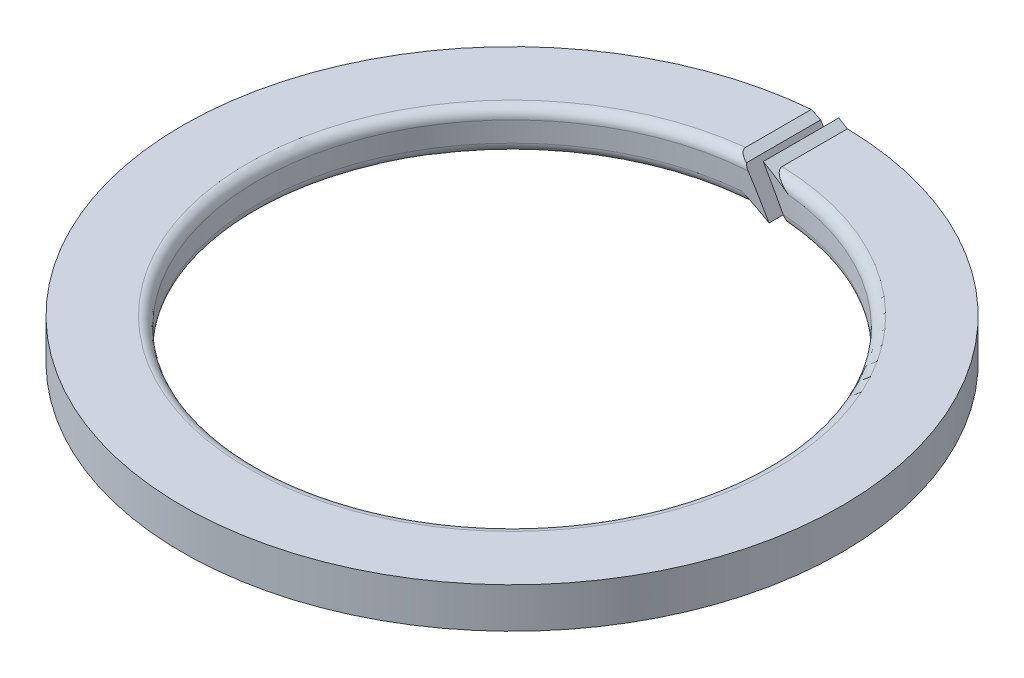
SolidWorks part; units mm, degrees
ref_plane "Front Plane" through (0, 0, 0) normal (0, 0, 1) x (1, 0, 0)
ref_plane "Top Plane" through (0, 0, 0) normal (0, 1, 0) x (1, 0, 0)
ref_plane "Right Plane" through (0, 0, 0) normal (1, 0, 0) x (0, 0, -1)
sketch "BodySke" plane through (0, 0, 0) normal (0, 0, 1) x (1, 0, 0)
  line L0 (0, 0) -> (0, 99.9596) construction
  line L1 (0, 0) -> (50.5, 0) construction
  line L3 (50.5, -10) -> (65.5, -10)
  line L4 (50.5, -10) -> (50.5, 10)
  line L5 (50.5, 10) -> (65.5, 10)
  line L6 (65.5, -10) -> (65.5, 10)
  line L7 (50.5, -4) -> (65.5, -4) construction
  line L8 (50.5, -4) -> (50.5, 4) construction
  line L9 (50.5, 4) -> (65.5, 4) construction
  line L10 (65.5, -4) -> (65.5, 4) construction
  dimension "Inner_dia" = 101
  dimension "Outer_dia" = 131
  dimension "D3" = 20
  dimension "Thickness" = 8
revolve "BaseBody" add sketch "BodySke" angle 360 about L0
sketch "Cut-ExtraSke" plane through (0, 0, 0) normal (0, 0, 1) x (1, 0, 0)
  line L1 (65.5, -4) -> (-65.5, -4)
  line L2 (65.5, -4) -> (65.5, -10)
  line L3 (65.5, -10) -> (-65.5, -10)
  line L4 (-65.5, -4) -> (-65.5, -10)
  line L5 (65.5, 4) -> (-65.5, 4)
  line L6 (65.5, 4) -> (65.5, 10)
  line L7 (65.5, 10) -> (-65.5, 10)
  line L8 (-65.5, 4) -> (-65.5, 10)
extrude "Cut-Extra" cut sketch "Cut-ExtraSke" along normal through all
sketch "ASke" plane through (0, 0, 0) normal (0, 0, 1) x (1, 0, 0)
  line L0 (0, -16.7192) -> (0, 28.802) construction
  line L1 (65.5, 4) -> (-65.5, 4) construction
  line L2 (0.5774, -5) -> (-4.6188, 4) construction
  line L4 (0.5774, -5) -> (-1.1547, -4)
  line L7 (-5.7735, 4) -> (-4.0415, 3)
  line L8 (-0.5774, 5) -> (4.6188, -4) construction
  line L9 (4.0415, -3) -> (5.7735, -4)
  line L10 (-65.5, 10) -> (65.5, 10)
  line L11 (-0.5774, 5) -> (1.1547, 4)
  line L12 (65.5, -4) -> (-65.5, -4) construction
  line L13 (65.5, 10) -> (65.5, 4)
  line L14 (65.5, 4) -> (1.1547, 4)
  line L15 (5.7735, -4) -> (65.5, -4)
  line L16 (65.5, -4) -> (65.5, -10)
  line L17 (65.5, -10) -> (-65.5, -10)
  line L18 (-65.5, -10) -> (-65.5, -4)
  line L19 (-65.5, -4) -> (-1.1547, -4)
  line L20 (0.5774, -5) -> (-4.0415, 3)
  line L21 (4.0415, -3) -> (-0.5774, 5)
  line L22 (-5.7735, 4) -> (-65.5, 4)
  line L23 (-65.5, 4) -> (-65.5, 10)
  line L24 (-65.5, 10) -> (-65.5, 4) construction
  line L25 (-65.5, -4) -> (-65.5, -10) construction
  line L26 (50.5, 10) -> (65.5, 10) construction
  line L27 (50.5, -10) -> (65.5, -10) construction
  point P11 (0, -4)
  point P12 (0, 4)
extrude "Type-A" cut sketch "ASke" against normal through all
sketch "BSke" plane through (0, 0, 0) normal (0, 0, 1) x (1, 0, 0)
  line L0 (0, 0) -> (0, 31.0126) construction
  line L1 (0, 0) -> (0, 99.9596) construction
  line L2 (0, -4) -> (-4.6188, 4)
  line L3 (65.5, 4) -> (-65.5, 4) construction
  line L4 (0, 4) -> (4.6188, -4)
  line L5 (-65.5, -4) -> (65.5, -4) construction
  line L6 (-50.5, -4) -> (50.5, -4) construction
  line L7 (0, -4) -> (-65.5, -4)
  line L8 (-65.5, -4) -> (-65.5, -10)
  line L9 (-65.5, -10) -> (65.5, -10)
  line L10 (65.5, -10) -> (65.5, -4)
  line L11 (65.5, -4) -> (4.6188, -4)
  line L12 (0, 4) -> (65.5, 4)
  line L13 (65.5, 4) -> (65.5, 10)
  line L14 (65.5, 10) -> (-65.5, 10)
  line L15 (-65.5, 10) -> (-65.5, 4)
  line L16 (-65.5, 4) -> (-4.6188, 4)
  line L17 (-65.5, 4) -> (-65.5, -4) construction
  dimension "Angle" = 30
extrude "Type-B" [suppressed] cut sketch "BSke" against normal through all
fillet "Fillet1" radius 2 2 edges at (-2.3149, -4, 50.4469) (2.3149, 4, 50.4469)
equation "\"D4@ASke\" = \"Offset@ASke\""
equation "\"D5@ASke\" = \"Offset@ASke\""
equation "\"D6@ASke\" = \"Offset@ASke\""
